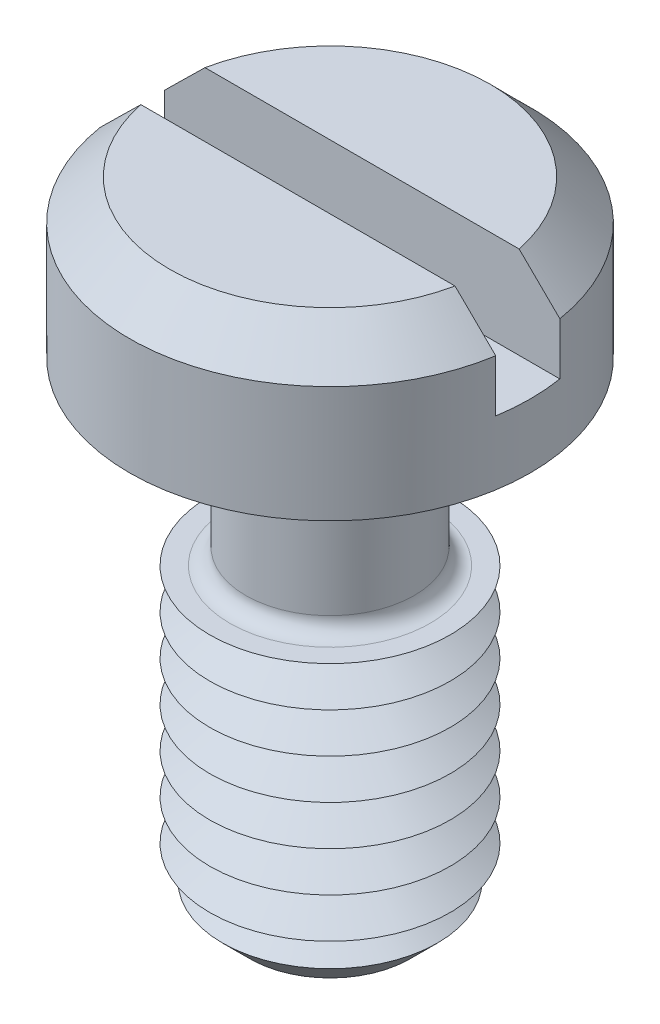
SolidWorks part; units mm, degrees
ref_plane "Front Plane" through (0, 0, 0) normal (0, 0, 1) x (1, 0, 0)
ref_plane "Top Plane" through (0, 0, 0) normal (0, 1, 0) x (1, 0, 0)
ref_plane "Right Plane" through (0, 0, 0) normal (1, 0, 0) x (0, 0, -1)
sketch "Sketch1" plane through (0, 0, 0) normal (0, 1, 0) x (1, 0, 0)
  circle A0 centre (0, 0) radius 5
  dimension "D1" = 10
extrude "Boss-Extrude1" add sketch "Sketch1" along normal blind 3.9
sketch "Sketch2" plane through (0, 0, 0) normal (0, -1, 0) x (1, 0, 0)
  circle A0 centre (0, 0) radius 2.1
  dimension "D1" = 4.2
extrude "Boss-Extrude2" add sketch "Sketch2" along normal blind 12
sketch "Sketch3" plane through (0, -12, 0) normal (0, -1, 0) x (1, 0, 0)
  circle A0 centre (0, 0) radius 3
  dimension "D1" = 6
extrude "Boss-Extrude3" add sketch "Sketch3" against normal blind 7.5
chamfer "Chamfer1" distance 1 angle 45 1 edges at (0, -12, -3)
sketch "Sketch4" plane through (0, 0, 0) normal (1, 0, 0) x (0, 0, -1)
  line L0 (0, -6.5871) -> (0, -12.0372) construction
sketch "Sketch5" plane through (0, 0, 0) normal (1, 0, 0) x (0, 0, -1)
  line L0 (-3, -4.5) -> (-2.134, -5)
  line L1 (-2.134, -5) -> (-3, -5.5)
  line L2 (-3, -4.5) -> (-3, -11) construction
  line L3 (-3, -5.5) -> (-3, -4.5)
  dimension "D1" = 1
revolve "Cut-Revolve1" cut sketch "Sketch5" angle 360 about L0
pattern_linear "LPattern1" count 7 spacing 1 along (0, -1, 0) of "Cut-Revolve1"
fillet "Fillet1" radius 0.4 2 edges at (0, -4.5, -2.1) (0, 0, -2.1)
chamfer "Chamfer2" distance 1 angle 45 1 edges at (0, 3.9, 5)
sketch "Sketch6" plane through (0, 3.9, 0) normal (0, 1, 0) x (1, 0, 0)
  line L1 (5, -0.8) -> (-5, -0.8)
  line L2 (5, -0.8) -> (5, 0.8)
  line L3 (5, 0.8) -> (-5, 0.8)
  line L4 (-5, -0.8) -> (-5, 0.8)
  line L5 (5, -0.8) -> (-5, 0.8) construction
  line L6 (5, 0.8) -> (-5, -0.8) construction
  circle A0 centre (0, 0) radius 5 construction
  point P0 (0, 0)
  dimension "D1" = 1.6
extrude "Cut-Extrude1" cut sketch "Sketch6" against normal blind 2.3
